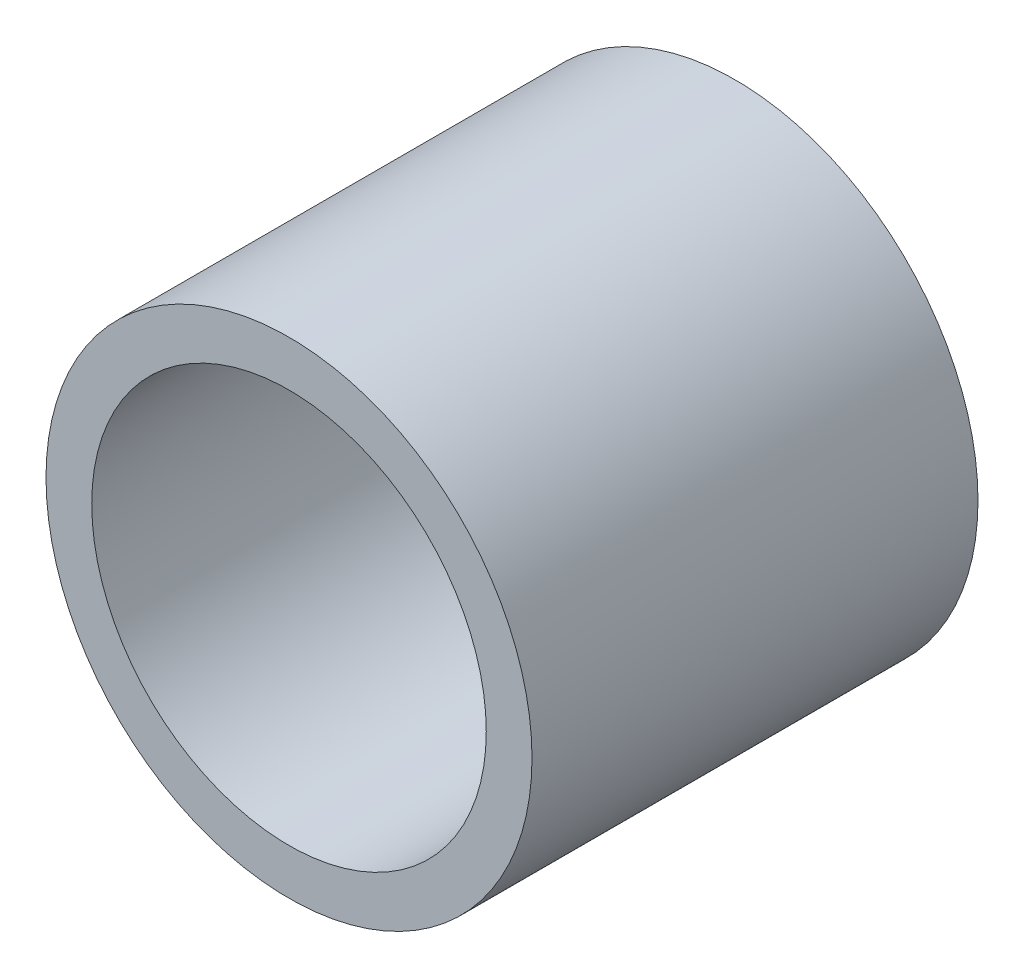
SolidWorks part; units mm, degrees
ref_plane "Plane1" through (0, 0, 0) normal (0, 0, 1) x (1, 0, 0)
ref_plane "Plane2" through (0, 0, 0) normal (0, 1, 0) x (1, 0, 0)
ref_plane "Plane3" through (0, 0, 0) normal (1, 0, 0) x (0, 0, -1)
sketch "Sketch1" plane through (0, 0, 0) normal (0, 0, 1) x (1, 0, 0)
  circle A0 centre (0, 0) radius 8.763
  circle A1 centre (0, 0) radius 10.795
extrude "Base-Extrude" add sketch "Sketch1" along normal blind 19.812
